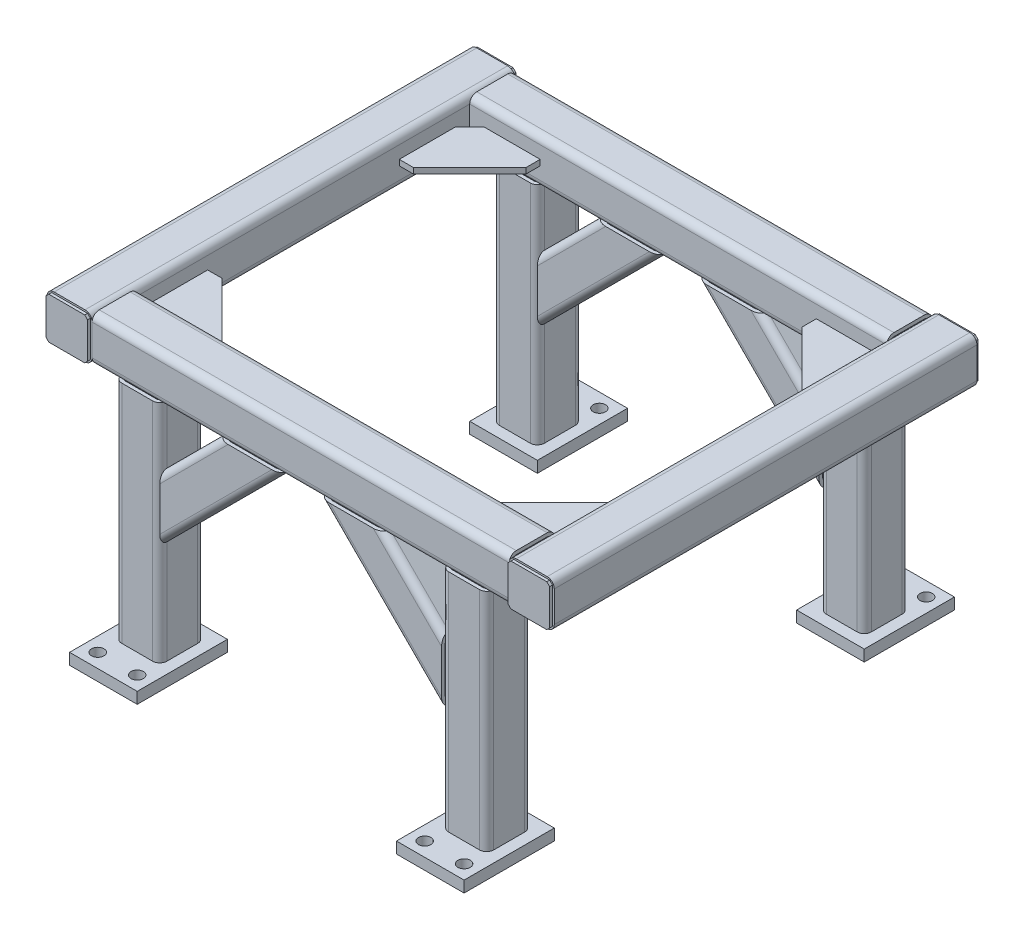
SolidWorks part; units mm, degrees
ref_plane "Front Plane" through (0, 0, 0) normal (0, 0, 1) x (1, 0, 0)
ref_plane "Top Plane" through (0, 0, 0) normal (0, 1, 0) x (1, 0, 0)
ref_plane "Right Plane" through (0, 0, 0) normal (1, 0, 0) x (0, 0, -1)
ref_plane "Top of Frame" through (0, 500, 0) normal (0, 1, 0) x (1, 0, 0)
ref_plane "Bottom of Legs" through (0, 20, 0) normal (0, 1, 0) x (1, 0, 0)
sketch "Upper Frame" plane through (0, 500, 0) normal (0, 1, 0) x (1, 0, 0)
  line L0 (-450, 375) -> (450, -375) construction
  line L1 (450, 375) -> (-450, 375)
  line L2 (450, 375) -> (450, -375)
  line L3 (450, -375) -> (-450, -375)
  line L4 (-450, 375) -> (-450, -375)
  dimension "D1" = 900
  dimension "D2" = 750
ref_plane "Front of Frame" through (0, 0, 375) normal (0, 0, 1) x (1, 0, 0)
sketch "Leg Sketch" plane through (0, 0, 375) normal (0, 0, 1) x (1, 0, 0)
  line L0 (-290, 20) -> (-290, 500)
  line L1 (0, 429.9862) -> (0, 0) construction
  line L2 (-290, 220) -> (-10, 500)
  line L3 (450, 500) -> (-450, 500) construction
  line L4 (50, 20) -> (-50, 20) construction
  dimension "D1" = 200
  dimension "D2" = 45
  dimension "D3" = 580
other "Tube (square) 80 X 80 X 6.3(1)"
ref_plane "Plane2" through (410, 460, -375) normal (0, 0, 1) x (1, 0, 0)
sketch "Sketch1" plane through (410, 460, -375) normal (0, 0, 1) x (1, 0, 0)
  line L0 (-27.4, -33.7) -> (27.4, -33.7)
  line L1 (-33.7, -27.4) -> (-33.7, 27.4)
  line L2 (27.4, 33.7) -> (-27.4, 33.7)
  line L3 (33.7, 27.4) -> (33.7, -27.4)
  line L4 (-27.4, -40) -> (27.4, -40)
  line L5 (-40, -27.4) -> (-40, 27.4)
  line L6 (27.4, 40) -> (-27.4, 40)
  line L7 (40, 27.4) -> (40, -27.4)
  line L8 (-40, 0) -> (-33.7, 0) construction
  line L9 (-33.7, 0) -> (33.7, 0) construction
  line L10 (33.7, 0) -> (40, 0) construction
  line L12 (0, 40) -> (0, 33.7) construction
  line L13 (0, 33.7) -> (0, -33.7) construction
  line L14 (0, -33.7) -> (0, -40) construction
  arc A0 (40, 27.4) -> (27.4, 40) centre (27.4, 27.4) ccw
  arc A1 (27.4, -40) -> (40, -27.4) centre (27.4, -27.4) ccw
  arc A2 (-40, -27.4) -> (-27.4, -40) centre (-27.4, -27.4) ccw
  arc A3 (-27.4, 40) -> (-40, 27.4) centre (-27.4, 27.4) ccw
  arc A4 (-27.4, 33.7) -> (-33.7, 27.4) centre (-27.4, 27.4) ccw
  arc A5 (33.7, 27.4) -> (27.4, 33.7) centre (27.4, 27.4) ccw
  arc A6 (27.4, -33.7) -> (33.7, -27.4) centre (27.4, -27.4) ccw
  arc A7 (-33.7, -27.4) -> (-27.4, -33.7) centre (-27.4, -27.4) ccw
  point P2 (-40, 40)
  point P33 (-40, -40)
  point P34 (40, -40)
  point P36 (40, 40)
  point P37 (0, 0)
  dimension "D1" = 12.6
  dimension "Thickness" = 6.3
  dimension "V_leg" = 80
  dimension "H_leg" = 80
sketch "Sketch2" plane through (0, 20, 0) normal (0, 1, 0) x (1, 0, 0)
  line L0 (-290, -375) -> (-290, -435) construction
  line L1 (-350, -435) -> (-230, -435)
  line L2 (-350, -435) -> (-350, -275)
  line L3 (-350, -275) -> (-230, -275)
  line L4 (-230, -435) -> (-230, -275)
  dimension "D1" = 120
  dimension "D2" = 160
  dimension "D3" = 60
extrude "Boss-Extrude1" add sketch "Sketch2" against normal blind 20 separate body
hole_wizard "M20 Clearance Hole1" positions "Sketch3" profile "Sketch4" hole size "M20" standard "ANSI Metric"
sketch "Sketch3" plane through (0, 20, 0) normal (0, 1, 0) x (1, 0, 0)
  line L0 (-325, -410) -> (-255, -410) construction
  line L3 (-290, -375) -> (-290, -410) construction
  line L4 (-317.4, -375) -> (-262.6, -375) construction
  line L6 (-350, -435) -> (-230, -435) construction
  point P0 (-325, -410)
  point P2 (-255, -410)
  dimension "D1" = 25
  dimension "D2" = 70
sketch "Sketch4" plane through (-325, 20, 410) normal (1, 0, 0) x (0, 0, 1)
  line L0 (0, 0) -> (0, 20)
  line L1 (0, 20) -> (11, 20)
  line L2 (11, 20) -> (11, 0)
  line L5 (11, 0) -> (0, 0)
  line L11 (0, -6.35) -> (0, 107.95) construction
  dimension "Thru Hole Dia." = 22
  dimension "Thru Hole Depth" = 20
other "Gusset1" parameters "D1"=10, "D2"=10, "D3"=0, "D4"=0, "D10"=5, "D11"=125, "D12"=125, "D13"=25, "D14"=45, "D15"=25, "D16"=25, "D17"=25, "D18"=45
sketch "Sketch5" plane through (-370, 460, 295) normal (0, 1, 0) x (1, 0, 0)
  line L0 (0, 25) -> (0, 125)
  line L1 (25, 0) -> (125, 0)
  line L2 (0, 25) -> (25, 0)
  line L3 (25, 125) -> (125, 25)
  line L4 (0, 125) -> (25, 125)
  line L5 (125, 0) -> (125, 25)
other "End cap1" parameters "D1"=5, "D2"=3, "D3"=5
mirror "Mirror1" about plane through (0, 0, 0) normal (1, 0, 0)
mirror "Mirror2" about plane through (0, 0, 0) normal (0, 0, 1)
